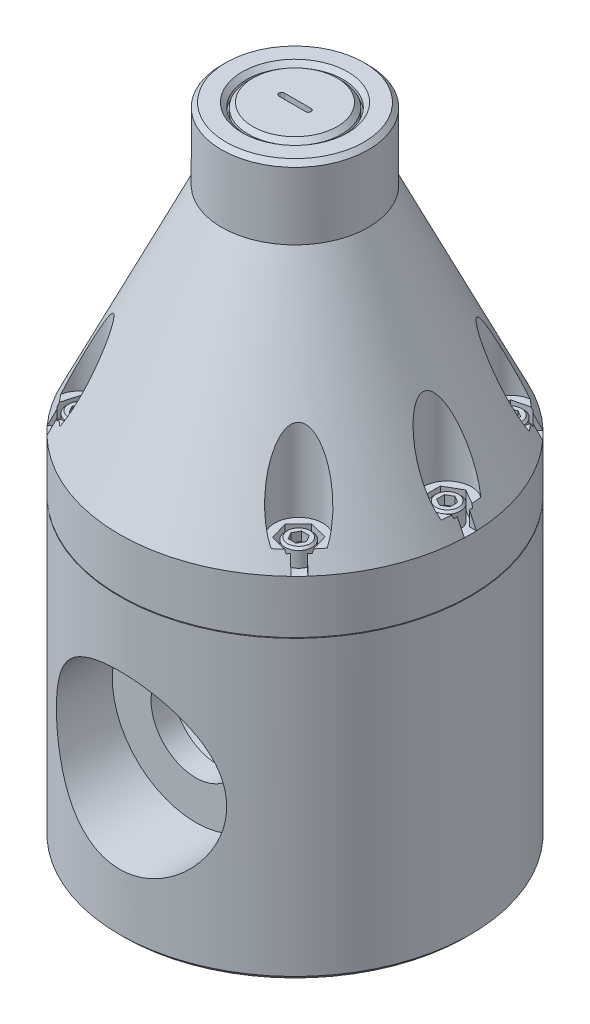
SolidWorks part; units mm, degrees
ref_plane "Front Plane" through (0, 0, 0) normal (0, 0, 1) x (1, 0, 0)
ref_plane "Top Plane" through (0, 0, 0) normal (0, 1, 0) x (1, 0, 0)
ref_plane "Right Plane" through (0, 0, 0) normal (1, 0, 0) x (0, 0, -1)
sketch "Sketch1" plane through (0, 0, 0) normal (0, 1, 0) x (1, 0, 0)
  circle A0 centre (0, 0) radius 62.23
  dimension "D1" = 124.46
extrude "Extrude1" add sketch "Sketch1" along normal blind 226.06
sketch "Sketch2" plane through (0, 0, 0) normal (0, 0, 1) x (1, 0, 0)
  line L0 (-67.5361, 105.41) -> (-45.085, 105.41)
  line L1 (-45.085, 105.41) -> (-45.085, 105.664)
  line L2 (-45.085, 105.664) -> (-62.23, 105.664)
  line L3 (-62.23, 105.664) -> (-62.23, 124.46)
  line L4 (-62.23, 124.46) -> (-26.035, 200.66)
  line L5 (-26.035, 200.66) -> (-26.035, 228.6)
  line L6 (-26.035, 228.6) -> (-77.4616, 228.6)
  line L7 (-77.4616, 228.6) -> (-77.4616, 105.41)
  line L8 (-77.4616, 105.41) -> (-67.5361, 105.41)
  line L9 (0, 0) -> (0, 226.06) construction
  line L10 (62.23, 226.06) -> (-62.23, 226.06) construction
  line L11 (-62.23, 0) -> (62.23, 0) construction
  dimension "D1" = 105.41
  dimension "D2" = 228.6
  dimension "D3" = 45.085
  dimension "D4" = 0.254
  dimension "D5" = 26.035
  dimension "D6" = 62.23
  dimension "D7" = 19.05
  dimension "D8" = 25.4
revolve "Cut-Revolve1" cut sketch "Sketch2" angle 360 about L9
ref_plane "Plane1" through (0, 130.683, 0) normal (0, 1, 0) x (-1, 0, 0)
sketch "Sketch3" plane through (0, 130.683, 0) normal (0, 1, 0) x (-1, 0, 0)
  line L0 (0, 0) -> (-62.23, 0) construction
  line L1 (0, 0) -> (-44.7645, 43.2286) construction
  line L2 (0, 0) -> (-44.7645, -43.2286) construction
  circle A0 centre (0, 0) radius 62.23 construction
  circle A1 centre (0, 0) radius 53.975 construction
  circle A2 centre (-38.8264, 37.4942) radius 8.5725
  circle A3 centre (-53.975, 0) radius 8.5725
  circle A4 centre (-38.8264, -37.4942) radius 8.5725
  dimension "D3" = 17.145
  dimension "D4" = 17.145
  dimension "D5" = 17.145
  dimension "D6" = 107.95
  dimension "D1" = 44
  dimension "D2" = 44
extrude "Extrude2" cut sketch "Sketch3" along normal blind 50.8
sketch "Sketch4" plane through (0, 130.683, 0) normal (0, 1, 0) x (-1, 0, 0)
  line L0 (0, 0) -> (-53.975, 0) construction
  line L1 (-53.975, 0) -> (-53.975, 8.5725) construction
  line L2 (0, 0) -> (-38.8264, 37.4942) construction
  line L3 (-38.8264, 37.4942) -> (-44.7813, 31.3276) construction
  line L4 (0, 0) -> (-38.8264, -37.4942) construction
  line L5 (-38.8264, -37.4942) -> (-44.7813, -31.3276) construction
  line L7 (-43.4105, 32.7472) -> (-37.0074, 31.1507)
  line L8 (-37.0074, 31.1507) -> (-32.4233, 35.8977)
  line L9 (-32.4233, 35.8977) -> (-34.2422, 42.2412)
  line L10 (-34.2422, 42.2412) -> (-40.6453, 43.8377)
  line L11 (-40.6453, 43.8377) -> (-45.2295, 39.0907)
  line L12 (-45.2295, 39.0907) -> (-43.4105, 32.7472)
  line L13 (-53.975, 6.5991) -> (-59.69, 3.2996)
  line L14 (-59.69, 3.2996) -> (-59.69, -3.2996)
  line L15 (-59.69, -3.2996) -> (-53.975, -6.5991)
  line L16 (-53.975, -6.5991) -> (-48.26, -3.2996)
  line L17 (-48.26, -3.2996) -> (-48.26, 3.2996)
  line L18 (-48.26, 3.2996) -> (-53.975, 6.5991)
  line L19 (-43.4105, -32.7472) -> (-45.2295, -39.0907)
  line L20 (-45.2295, -39.0907) -> (-40.6453, -43.8377)
  line L21 (-40.6453, -43.8377) -> (-34.2422, -42.2412)
  line L22 (-34.2422, -42.2412) -> (-32.4233, -35.8977)
  line L23 (-32.4233, -35.8977) -> (-37.0074, -31.1507)
  line L24 (-37.0074, -31.1507) -> (-43.4105, -32.7472)
  arc A0 (-58.8534, -7.049) -> (-58.8534, 7.049) centre (-53.975, 0) ccw construction
  arc A1 (-47.2323, 35.8124) -> (-37.439, 45.9537) centre (-38.8264, 37.4942) ccw construction
  arc A2 (-37.439, -45.9537) -> (-47.2323, -35.8124) centre (-38.8264, -37.4942) ccw construction
  circle A3 centre (-38.8264, 37.4942) radius 5.715 construction
  circle A4 centre (-53.975, 0) radius 5.715 construction
  circle A5 centre (-38.8264, -37.4942) radius 5.715 construction
extrude "Extrude3" cut sketch "Sketch4" against normal blind 6.223
sketch "Sketch5" plane through (0, 130.683, 0) normal (0, 1, 0) x (-1, 0, 0)
  line L0 (0, 0) -> (-44.7645, 43.2286) construction
  line L1 (0, 0) -> (-62.23, 0) construction
  line L2 (0, 0) -> (-44.7645, -43.2286) construction
  line L3 (-39.9479, 41.5433) -> (-44.6727, 46.106)
  line L4 (-43.1488, 38.7022) -> (-47.4921, 42.8965)
  line L5 (-43.1488, 38.7022) -> (-39.9479, 41.5433)
  line L6 (-44.6727, 46.106) -> (-47.4921, 42.8965)
  line L7 (-56.5177, 2.1336) -> (-64.1724, 2.1336)
  line L8 (-56.5177, -2.1336) -> (-64.1724, -2.1336)
  line L9 (-64.1724, -2.1336) -> (-64.1724, 2.1336)
  line L10 (-56.5177, 2.1336) -> (-56.5177, -2.1336)
  line L11 (-41.4493, -37.061) -> (-47.6581, -43.0568)
  line L12 (-38.8718, -40.5042) -> (-44.7525, -46.183)
  line L13 (-41.4493, -37.061) -> (-38.8718, -40.5042)
  line L14 (-44.7525, -46.183) -> (-47.6581, -43.0568)
  circle A0 centre (0, 0) radius 62.23 construction
  dimension "D1" = 44
  dimension "D2" = 44
  dimension "D3" = 2.1336
  dimension "D4" = 2.1336
  dimension "D5" = 2.1336
  dimension "D6" = 2.1336
  dimension "D7" = 2.1336
  dimension "D8" = 2.1336
extrude "Extrude4" cut sketch "Sketch5" against normal blind 6.223
sketch "Sketch6" plane through (0, 130.683, 0) normal (0, 1, 0) x (-1, 0, 0)
  circle A0 centre (-38.8264, 37.4942) radius 4.7625
  circle A1 centre (-53.975, 0) radius 4.7625
  circle A2 centre (-38.8264, -37.4942) radius 4.7625
  dimension "D1" = 9.525
  dimension "D2" = 9.525
  dimension "D3" = 9.525
extrude "Extrude6" add sketch "Sketch6" against normal up to surface (6.223 mm away)
sketch "Sketch7" plane through (0, 130.683, 0) normal (0, 1, 0) x (-1, 0, 0)
  line L1 (-41.5687, 37.4942) -> (-40.1975, 35.1193)
  line L2 (-40.1975, 35.1193) -> (-37.4552, 35.1193)
  line L3 (-37.4552, 35.1193) -> (-36.0841, 37.4942)
  line L4 (-36.0841, 37.4942) -> (-37.4552, 39.8691)
  line L5 (-37.4552, 39.8691) -> (-40.1975, 39.8691)
  line L6 (-40.1975, 39.8691) -> (-41.5687, 37.4942)
  line L7 (-53.975, 2.7423) -> (-56.3499, 1.3711)
  line L8 (-56.3499, 1.3711) -> (-56.3499, -1.3711)
  line L9 (-56.3499, -1.3711) -> (-53.975, -2.7423)
  line L10 (-53.975, -2.7423) -> (-51.6001, -1.3711)
  line L11 (-51.6001, -1.3711) -> (-51.6001, 1.3711)
  line L12 (-51.6001, 1.3711) -> (-53.975, 2.7423)
  line L13 (-38.8264, -34.7519) -> (-41.2013, -36.123)
  line L14 (-41.2013, -36.123) -> (-41.2013, -38.8653)
  line L15 (-41.2013, -38.8653) -> (-38.8264, -40.2365)
  line L16 (-38.8264, -40.2365) -> (-36.4515, -38.8653)
  line L17 (-36.4515, -38.8653) -> (-36.4515, -36.123)
  line L18 (-36.4515, -36.123) -> (-38.8264, -34.7519)
  circle A0 centre (-38.8264, 37.4942) radius 2.3749 construction
  circle A1 centre (-53.975, 0) radius 2.3749 construction
  circle A2 centre (-38.8264, -37.4942) radius 2.3749 construction
extrude "Extrude7" cut sketch "Sketch7" against normal blind 3.175
chamfer "Chamfer1" distance 0.762 angle 45 3 edges at (38.8264, 130.683, -32.7317) (53.975, 130.683, 4.7625) (38.8264, 130.683, 42.2567)
mirror "Mirror1" about plane through (0, 0, 0) normal (1, 0, 0) of "Chamfer1", "Extrude7", "Extrude6", "Extrude4", "Extrude3", "Extrude2"
ref_plane "Plane2" through (0, 226.06, 0) normal (0, 1, 0) x (-1, 0, 0)
sketch "Sketch8" plane through (0, 226.06, 0) normal (0, 1, 0) x (-1, 0, 0)
  circle A0 centre (0, 0) radius 17.145
  dimension "D1" = 34.29
extrude "Extrude8" cut sketch "Sketch8" against normal blind 3.175
sketch "Sketch9" plane through (0, 226.06, 0) normal (0, 1, 0) x (-1, 0, 0)
  circle A0 centre (0, 0) radius 16.51
  dimension "D1" = 33.02
extrude "Extrude9" add sketch "Sketch9" against normal up to surface (3.175 mm away)
sketch "Sketch10" plane through (0, 226.06, 0) normal (0, 1, 0) x (-1, 0, 0)
  line L0 (4.7625, 0) -> (-4.7625, 0) construction
  line L1 (-4.7625, 0.9652) -> (4.7625, 0.9652)
  line L2 (4.7625, -0.9652) -> (-4.7625, -0.9652)
  arc A0 (-4.7625, 0.9652) -> (-4.7625, -0.9652) centre (-4.7625, 0) ccw
  arc A1 (4.7625, -0.9652) -> (4.7625, 0.9652) centre (4.7625, 0) ccw
  dimension "D1" = 4.7625
  dimension "D2" = 9.525
  dimension "D3" = 0.9652
  dimension "D4" = 0.9652
extrude "Extrude10" cut sketch "Sketch10" against normal blind 3.175
chamfer "Chamfer2" distance 1.5748 angle 45 2 edges at (0, 226.06, 17.145) (0, 226.06, 26.035)
chamfer "Chamfer3" distance 1.5748 angle 45 1 edges at (0, 226.06, 16.51)
chamfer "Chamfer4" distance 1.5748 angle 45 1 edges at (0, 0, 62.23)
ref_plane "Plane3" through (0, 0, 62.23) normal (0, 0, 1) x (1, 0, 0)
hole_wizard "2 NPT Tapped Hole2" positions "3DSketch1" profile "Sketch13" size "2" standard "Ansi Inch"
sketch3d "3DSketch1"
  point P0 (0, 52.07, 62.23)
sketch "Sketch13" plane through (0, 52.07, 62.23) normal (1, 0, 0) x (0, -1, 0)
  line L0 (0, 0) -> (0, 44.4637)
  line L1 (15.875, 34.925) -> (0, 44.4637)
  line L2 (-15.875, 34.925) -> (0, 44.4637) construction
  line L3 (15.875, 34.925) -> (15.875, 27.051)
  line L4 (15.875, 27.051) -> (29.6325, 27.051)
  line L5 (29.6325, 27.051) -> (30.4424, 0)
  line L6 (-29.6325, 27.051) -> (-30.4424, 0) construction
  line L7 (30.4424, 0) -> (0, 0)
  line L8 (0, -6.35) -> (0, 107.95) construction
  line L11 (-15.875, 27.051) -> (-29.6325, 27.051) construction
  dimension "Tap Drill Dia." = 31.75
  dimension "Tap Drill Depth" = 34.925
  dimension "Thread Dia." = 60.8849
  dimension "Thread Angle" = 3.43
  dimension "Thread Depth" = 27.051
  dimension "Drill Angle" = 118
mirror "Mirror2" about plane through (0, 0, 0) normal (0, 0, 1) of "2 NPT Tapped Hole2"
